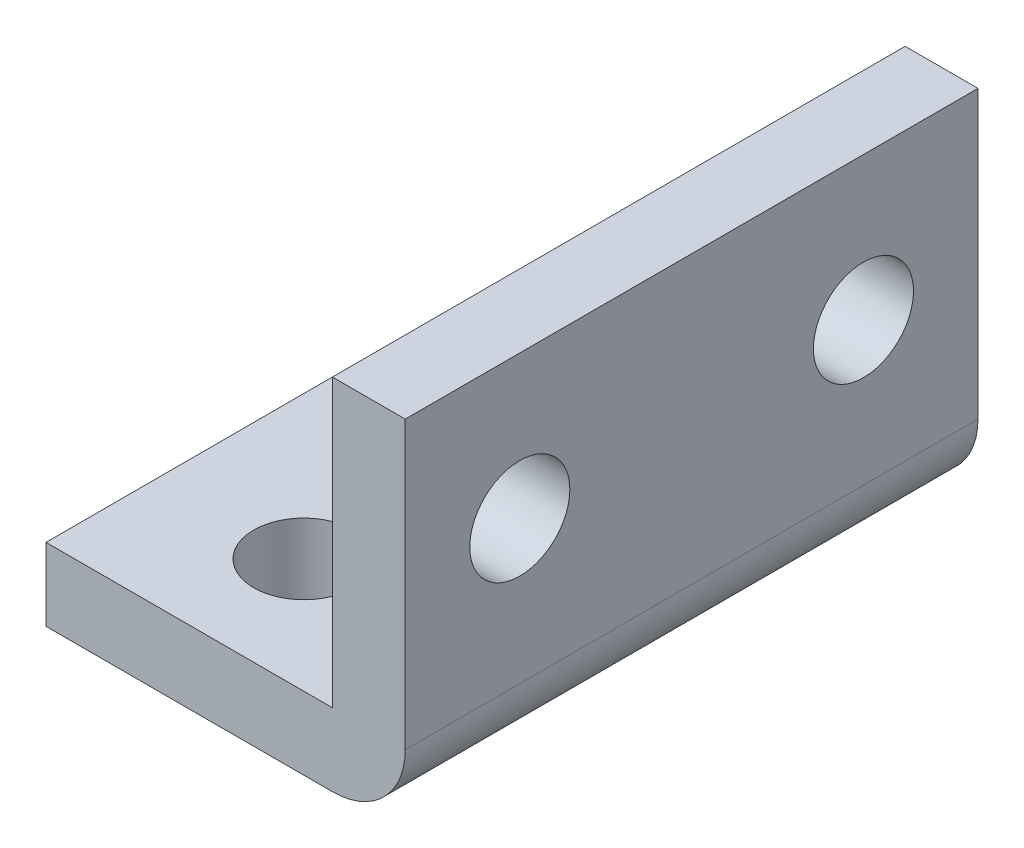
SolidWorks part; units mm, degrees
ref_plane "Front Plane" through (0, 0, 0) normal (0, 0, 1) x (1, 0, 0)
ref_plane "Top Plane" through (0, 0, 0) normal (0, 1, 0) x (1, 0, 0)
ref_plane "Right Plane" through (0, 0, 0) normal (1, 0, 0) x (0, 0, -1)
sketch "Sketch1" plane through (0, 0, 0) normal (0, 1, 0) x (1, 0, 0)
  line L0 (0, -12.5) -> (0, 12.5) construction
  line L1 (-6.25, -12.5) -> (6.25, -12.5)
  line L2 (-6.25, -12.5) -> (-6.25, 12.5)
  line L3 (-6.25, 12.5) -> (6.25, 12.5)
  line L4 (6.25, -12.5) -> (6.25, 12.5)
  line L5 (-6.25, -12.5) -> (6.25, 12.5) construction
  line L6 (-6.25, 12.5) -> (6.25, -12.5) construction
  line L7 (-6.25, 0) -> (6.25, 0) construction
  circle A0 centre (0, 7.5) radius 2.1844
  circle A1 centre (0, -7.5) radius 2.1844
  point P1 (0, 0)
extrude "Boss-Extrude1" add sketch "Sketch1" along normal blind 3.175
sketch "Sketch4" plane through (0, 0, 0) normal (0, -1, 0) x (1, 0, 0)
  line L0 (6.25, 12.5) -> (6.25, -12.5)
extrude "Extrude-Thin1" add sketch "Sketch4" against normal blind 15.675 thin
sketch "Sketch6" plane through (6.25, 0, 0) normal (-1, 0, 0) x (0, 0, 1)
  line L0 (-12.5, 9.425) -> (12.5, 9.425) construction
  line L1 (-12.5, 15.675) -> (-12.5, 3.175) construction
  line L2 (12.5, 15.675) -> (12.5, 3.175) construction
  line L3 (0, 9.425) -> (0, 12.7704) construction
  circle A0 centre (-7.5, 9.425) radius 2.1844
  circle A1 centre (7.5, 9.425) radius 2.1844
extrude "Cut-Extrude1" cut sketch "Sketch6" against normal through all
fillet "Fillet1" radius 3.175 1 edges at (9.43, 0, 0)
equation "\"HoleDiameter\" = 4.3688mm"
equation "\"D3@Sketch1\"=\"HoleDiameter\""
equation "\"PlateThickness\"= 0.125in"
equation "\"D1@Boss-Extrude1\"=\"PlateThickness\""
equation "\"D1@Extrude-Thin1\"=\"PlateThickness\"+12.5mm"
equation "\"D1@Sketch6\"=\"HoleDiameter\""
equation "\"D1@Fillet1\"=\"PlateThickness\""
